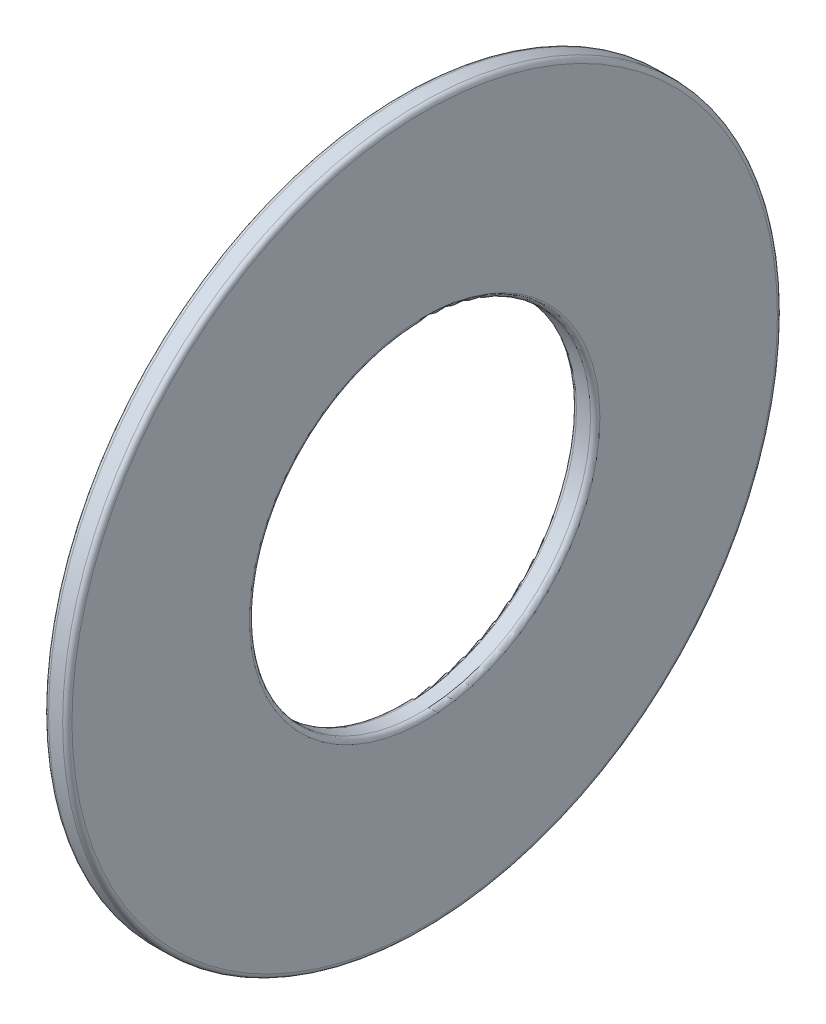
SolidWorks part; units mm, degrees
ref_plane "Front Plane" through (0, 0, 0) normal (0, 0, 1) x (1, 0, 0)
ref_plane "Top Plane" through (0, 0, 0) normal (0, 1, 0) x (1, 0, 0)
ref_plane "Right Plane" through (0, 0, 0) normal (1, 0, 0) x (0, 0, -1)
sketch "Sketch3" plane through (0, 0, 0) normal (0, 0, 1) x (1, 0, 0)
  line L0 (-1.143, 0) -> (1.143, 0) construction
  line L1 (0, -34.925) -> (0, 34.925) construction
  line L2 (0, -16.6624) -> (0, 16.6624) construction
  line L4 (1.143, -34.925) -> (-1.143, -34.925)
  line L5 (1.143, -34.925) -> (1.143, 34.925)
  line L6 (1.143, 34.925) -> (-1.143, 34.925)
  line L7 (-1.143, -34.925) -> (-1.143, 34.925)
  line L8 (0, 34.925) -> (0, -34.925) construction
  line L9 (1.143, 0) -> (-1.143, 0) construction
  point P0 (0, 0)
  point P4 (0, 0)
  point P8 (0, 0)
  point P11 (0, 0)
sketch "Sketch1" plane through (0, 0, 0) normal (1, 0, 0) x (0, 0, -1)
  circle A0 centre (0, 0) radius 34.925
  circle A1 centre (0, 0) radius 16.6624
extrude "Boss-Extrude1" add sketch "Sketch1" along normal mid plane 2.286
fillet "Fillet1" radius 0.4572 4 edges at (1.143, 0, -34.925) (-1.143, 0, -34.925) (1.143, 0, -16.6624) (-1.143, 0, -16.6624)
sketch "Sketch4" plane through (-1.143, 0, 0) normal (-1, 0, 0) x (0, 0, 1)
  line L0 (0, -34.925) -> (0, 34.925) construction
  line L1 (0, -34.925) -> (0, 34.925) construction
  circle A0 centre (0, 0) radius 16.6624 construction
  circle A1 centre (0, 0) radius 34.925 construction
  circle A2 centre (0, 0) radius 16.6624 construction
  circle A3 centre (0, 0) radius 34.925 construction
  point P0 (0, -16.6624)
  point P1 (0, 16.6624)
  point P5 (-34.925, 0)
  point P9 (-16.6624, 0)
  point P10 (16.6624, 0)
  point P11 (34.925, 0)
equation "\"D1@Boss-Extrude1\" = \"Thickness@Sketch3\""
equation "\"D1@Fillet1\"=\"Thickness@Sketch3\"*.2"
